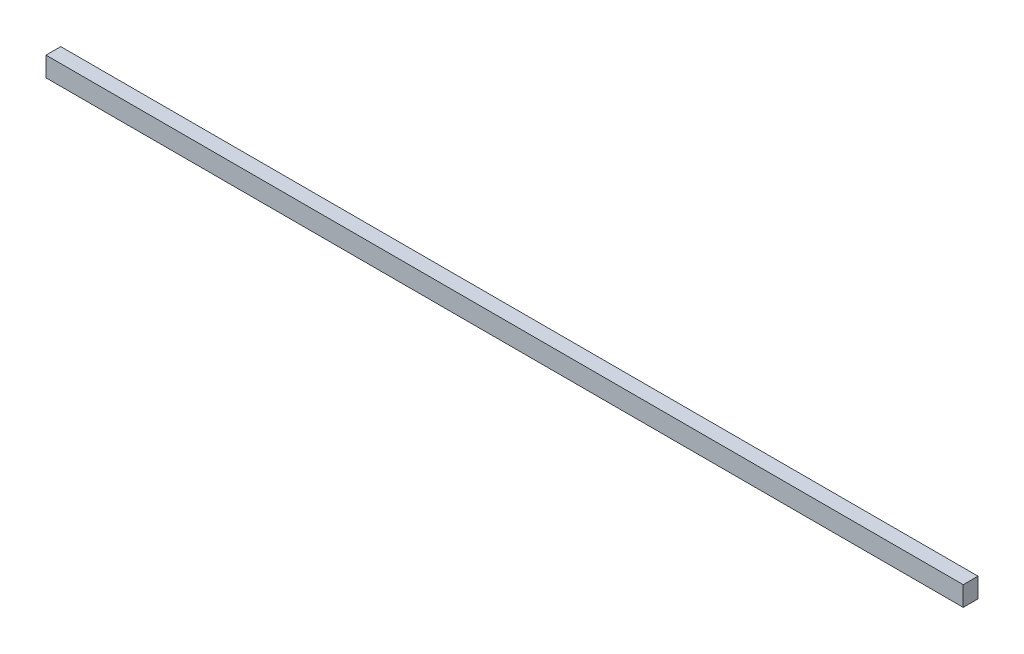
SolidWorks part; units mm, degrees
ref_plane "Front Plane" through (0, 0, 0) normal (0, 0, 1) x (1, 0, 0)
ref_plane "Top Plane" through (0, 0, 0) normal (0, 1, 0) x (1, 0, 0)
ref_plane "Right Plane" through (0, 0, 0) normal (1, 0, 0) x (0, 0, -1)
sketch "Sketch1" plane through (0, 0, 0) normal (0, 0, 1) x (1, 0, 0)
  line L1 (-71.7054, 37.3255) -> (165.0226, 37.3255)
  line L2 (-71.7054, 37.3255) -> (-71.7054, 32.2455)
  line L3 (-71.7054, 32.2455) -> (165.0226, 32.2455)
  line L4 (165.0226, 37.3255) -> (165.0226, 32.2455)
  dimension "D1" = 236.728
  dimension "D2" = 5.08
extrude "Extrude1" add sketch "Sketch1" along normal blind 3.81
